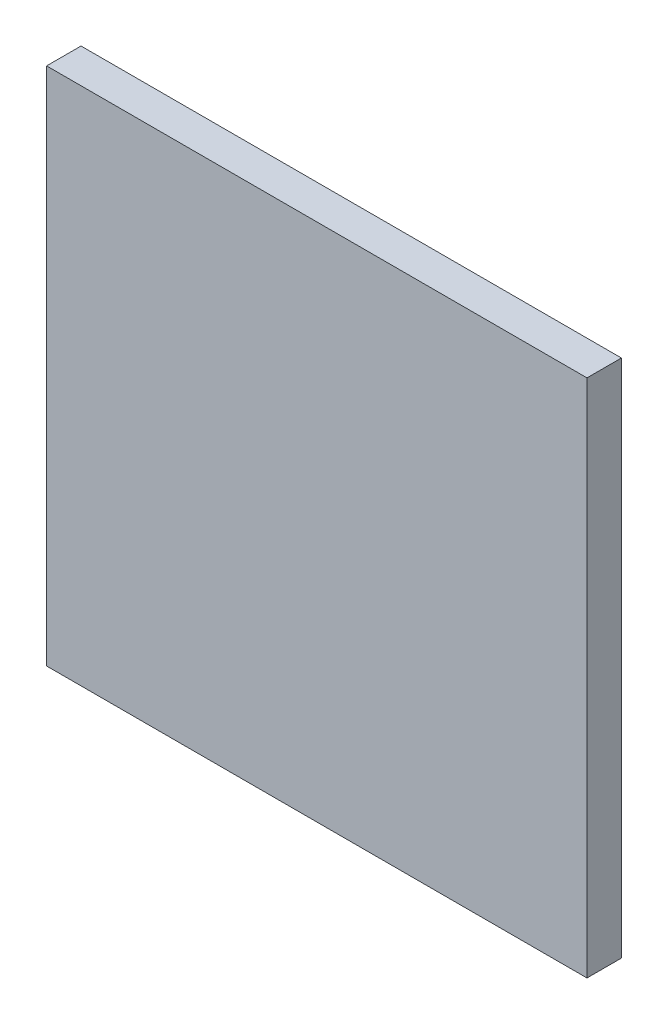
SolidWorks part; units mm, degrees
ref_plane "Plan de face" through (0, 0, 0) normal (0, 0, 1) x (1, 0, 0)
ref_plane "Plan de dessus" through (0, 0, 0) normal (0, 1, 0) x (1, 0, 0)
ref_plane "Plan de droite" through (0, 0, 0) normal (1, 0, 0) x (0, 0, -1)
sketch "Esquisse1" plane through (0, 0, 0) normal (0, 0, 1) x (1, 0, 0)
  line L1 (-45.6944, 37.1041) -> (111.3056, 37.1041)
  line L2 (-45.6944, 37.1041) -> (-45.6944, -113.8959)
  line L3 (-45.6944, -113.8959) -> (111.3056, -113.8959)
  line L4 (111.3056, 37.1041) -> (111.3056, -113.8959)
  dimension "D1" = 157
  dimension "D2" = 151
extrude "Boss.-Extru.1" add sketch "Esquisse1" along normal blind 10
